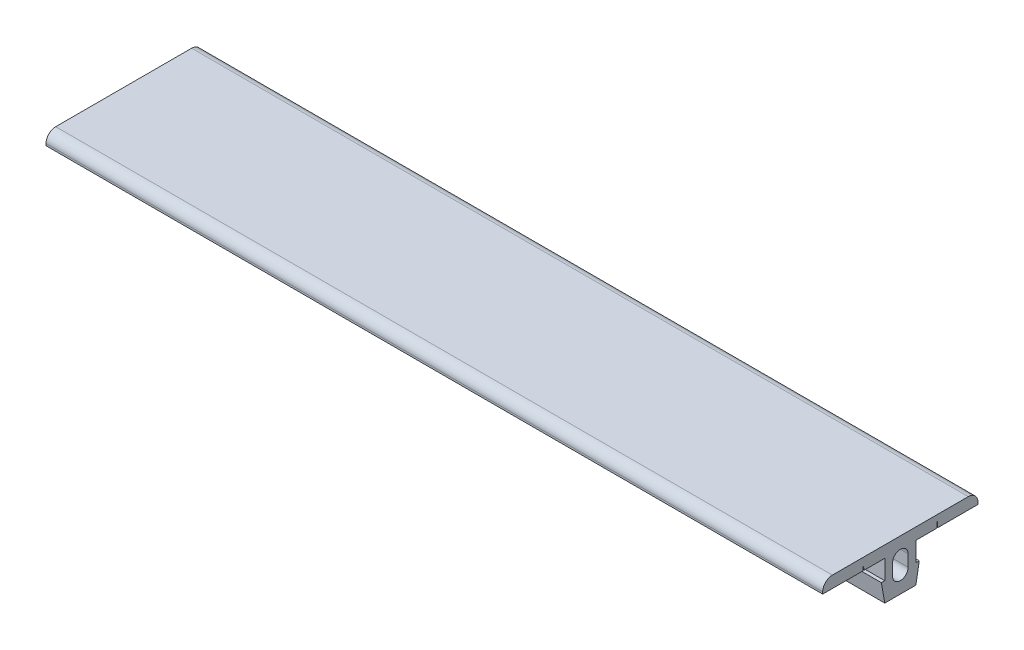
SolidWorks part; units mm, degrees
ref_plane "Front Plane" through (0, 0, 0) normal (0, 0, 1) x (1, 0, 0)
ref_plane "Top Plane" through (0, 0, 0) normal (0, 1, 0) x (1, 0, 0)
ref_plane "Right Plane" through (0, 0, 0) normal (1, 0, 0) x (0, 0, -1)
sketch3d "3DSketch1"
  line L0 (0, 0, 0) -> (200, 0, 0)
other "Suojakumit 1.6028 SUOJAKUMI NBR(1)"
ref_plane "Plane1" through (0, 0, 0) normal (1, 0, 0) x (0, 0, -1)
sketch "Sketch1" plane through (0, 0, 0) normal (1, 0, 0) x (0, 0, -1)
  line L0 (2, -1.5656) -> (2, 1.4344)
  line L1 (-2, 1.4344) -> (-2, -1.5656)
  line L2 (9.6311, 3.4344) -> (20, 3.4344)
  line L3 (20, 3.4344) -> (20, 3.9344)
  line L4 (17.5, 6.4344) -> (-17.5, 6.4344)
  line L5 (-20, 3.9344) -> (-20, 3.4344)
  line L6 (-20, 3.4344) -> (-9.6311, 3.4344)
  line L7 (-9.6311, 3.4344) -> (-9.5, 4.9337)
  line L8 (-9.5, 4.9337) -> (-9.3689, 3.4344)
  line L9 (-9.3689, 3.4344) -> (-4, 3.4344)
  line L10 (-4, 3.4344) -> (-4, -1.5656)
  line L11 (-4, -1.5656) -> (-4.8816, -1.5656)
  line L12 (-4.8816, -1.5656) -> (-4, -6.5656)
  line L13 (-4, -6.5656) -> (4, -6.5656)
  line L14 (4, -6.5656) -> (4.8816, -1.5656)
  line L15 (4.8816, -1.5656) -> (4, -1.5656)
  line L16 (4, -1.5656) -> (4, 3.4344)
  line L17 (4, 3.4344) -> (9.3689, 3.4344)
  line L18 (9.3689, 3.4344) -> (9.5, 4.9337)
  line L19 (9.5, 4.9337) -> (9.6311, 3.4344)
  arc A0 (-2, -1.5656) -> (2, -1.5656) centre (0, -1.5656) ccw
  arc A1 (2, 1.4344) -> (-2, 1.4344) centre (0, 1.4344) ccw
  arc A2 (20, 3.9344) -> (17.5, 6.4344) centre (17.5, 3.9344) ccw
  arc A3 (-17.5, 6.4344) -> (-20, 3.9344) centre (-17.5, 3.9344) ccw
  point P28 (0, 0)
